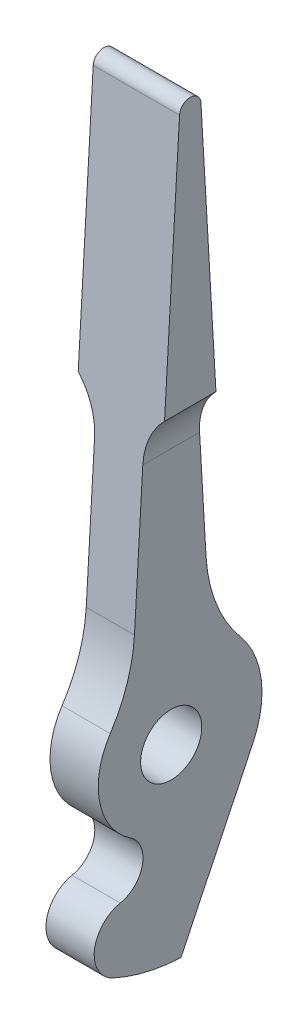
SolidWorks part; units mm, degrees
ref_plane "Спереди" through (0, 0, 0) normal (0, 0, 1) x (1, 0, 0)
ref_plane "Сверху" through (0, 0, 0) normal (0, 1, 0) x (1, 0, 0)
ref_plane "Справа" through (0, 0, 0) normal (1, 0, 0) x (0, 0, -1)
sketch "Эскиз1" plane through (0, 0, 0) normal (1, 0, 0) x (0, 0, -1)
  line L0 (0, 0) -> (0, 48.641) construction
  line L1 (-3.1332, 9.6572) -> (-0.9129, 47.7798)
  line L2 (0.9129, 47.7798) -> (2.9724, 12.4195)
  line L3 (6.9826, -3.3555) -> (0.8341, -16.1503)
  line L4 (0, 0) -> (-8.9061, -18.5331) construction
  line L5 (-10.7936, 5.1021) -> (9.8355, -4.6492) construction
  line L6 (-7.4051, -19.1626) -> (2.8433, 2.1636) construction
  line L7 (0, 0) -> (-17.6996, 0) construction
  line L8 (1.7476, -14.9157) -> (-6.2965, -11.0502) construction
  circle A0 centre (0, 0) radius 2.6098
  arc A1 (0.9129, 47.7798) -> (-0.9129, 47.7798) centre (0, 47.7266) ccw
  arc A2 (2.9724, 12.4195) -> (5.9298, 4.9853) centre (15.6509, 13.1579) ccw
  arc A3 (5.9298, 4.9853) -> (6.9826, -3.3555) centre (0, 0) cw
  arc A4 (0.8341, -16.1503) -> (-4.9501, -14.7682) centre (1.4697, -0.6947) cw
  arc A5 (-3.1332, 9.6572) -> (-5.1998, 3.4187) centre (-15.8118, 10.3956) cw
  arc A6 (-5.1998, 3.4187) -> (-3.4706, -5.1653) centre (0, 0) ccw
  arc A7 (-3.4706, -5.1653) -> (-4.3436, -9.5344) centre (-4.8164, -7.1682) cw
  arc A8 (-4.3436, -9.5344) -> (-4.9501, -14.7682) centre (-3.8011, -12.2493) ccw
  dimension "D4" = 0.9144
  dimension "D5" = 7.747
  dimension "D6" = 12.7
  dimension "D10" = 15.4686
  dimension "D11" = 12.7
  dimension "D12" = 6.223
  dimension "D13" = 5.2197
  dimension "D14" = 2.413
  dimension "D15" = 2.7686
  dimension "D1" = 3.333
  dimension "D2" = 6.667
  dimension "D3" = 48.641
  dimension "D7" = 25.667
  dimension "D8" = 1.6256
  dimension "D9" = 25.3
  dimension "D16" = 0.889
extrude "Бобышка-Вытянуть1" add sketch "Эскиз1" along normal mid plane 7.366
sketch "Эскиз2" plane through (0, 0, 0) normal (0, 0, 1) x (1, 0, 0)
  line L0 (2.0574, -16.1503) -> (2.0574, 21.8698)
  line L1 (0, 0) -> (0, 52.2258) construction
  line L2 (3.683, 25.7969) -> (3.683, -16.1503)
  line L3 (3.683, -16.1503) -> (2.0574, -16.1503)
  line L4 (3.683, -16.1503) -> (-3.683, -16.1503) construction
  line L5 (3.683, -16.1503) -> (3.683, -3.3555) construction
  line L6 (-3.683, -16.1503) -> (-2.0574, -16.1503)
  line L7 (-3.683, 25.7969) -> (-3.683, -16.1503)
  line L8 (-2.0574, -16.1503) -> (-2.0574, 21.8698)
  arc A0 (3.683, 25.7969) -> (2.0574, 21.8698) centre (7.6136, 21.8698) ccw
  arc A1 (-3.683, 25.7969) -> (-2.0574, 21.8698) centre (-7.6136, 21.8698) cw
  dimension "D1" = 5.5562
  dimension "D2" = 4.1148
  dimension "D3" = 25.7969
extrude "Вырез-Вытянуть1" cut sketch "Эскиз2" against normal mid plane 25.146
